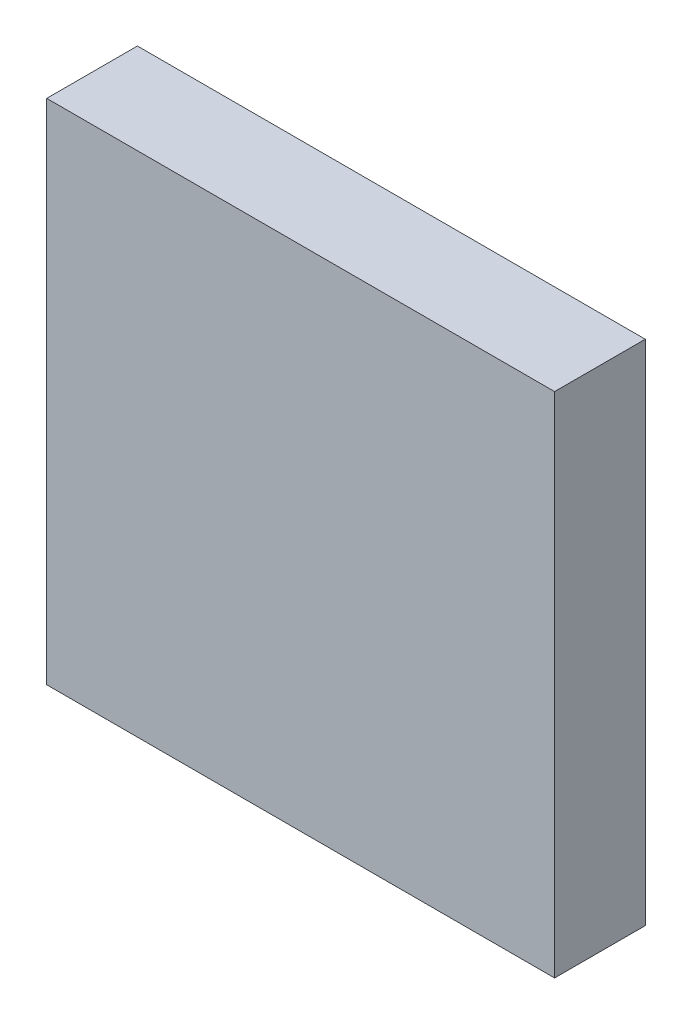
SolidWorks part; units mm, degrees
ref_plane "Plan de face" through (0, 0, 0) normal (0, 0, 1) x (1, 0, 0)
ref_plane "Plan de dessus" through (0, 0, 0) normal (0, 1, 0) x (1, 0, 0)
ref_plane "Plan de droite" through (0, 0, 0) normal (1, 0, 0) x (0, 0, -1)
sketch "Esquisse1" plane through (0, 0, 0) normal (0, 0, 1) x (1, 0, 0)
  line L1 (-45.4471, 36.2224) -> (122.5529, 36.2224)
  line L2 (-45.4471, 36.2224) -> (-45.4471, -131.7776)
  line L3 (-45.4471, -131.7776) -> (122.5529, -131.7776)
  line L4 (122.5529, 36.2224) -> (122.5529, -131.7776)
  dimension "D1" = 168
  dimension "D2" = 168
extrude "Boss.-Extru.1" add sketch "Esquisse1" along normal blind 30
